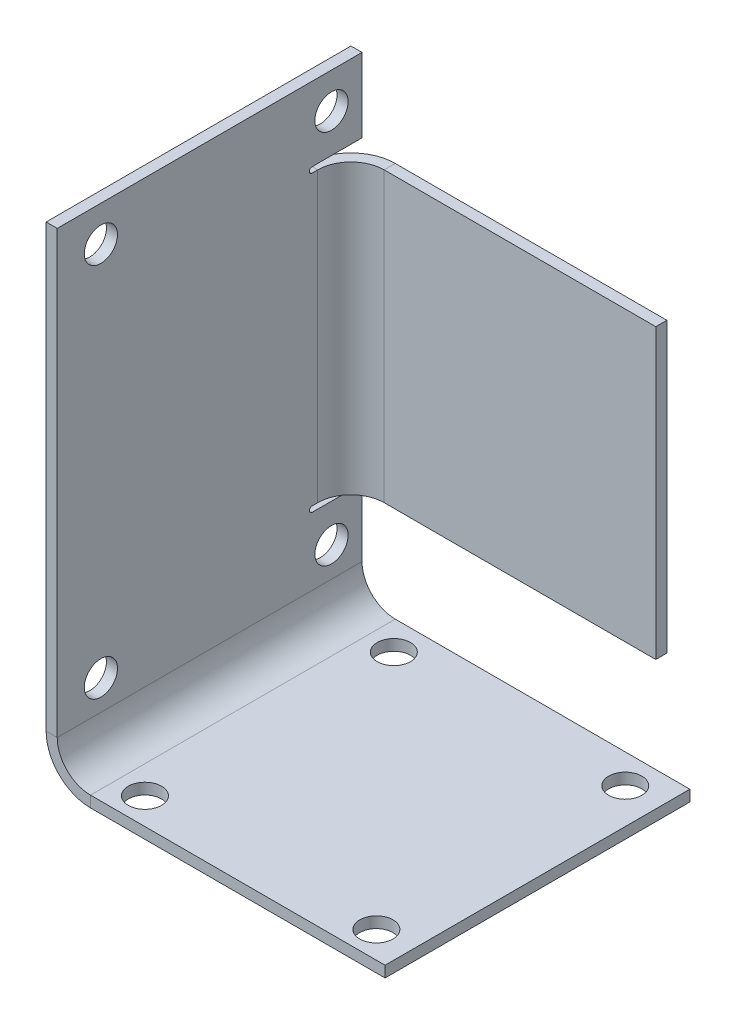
SolidWorks part; units mm, degrees
ref_plane "Alzado" through (0, 0, 0) normal (0, 0, 1) x (1, 0, 0)
ref_plane "Planta" through (0, 0, 0) normal (0, 1, 0) x (1, 0, 0)
ref_plane "Vista lateral" through (0, 0, 0) normal (1, 0, 0) x (0, 0, -1)
sketch "Croquis1" plane through (0, 0, 0) normal (0, 0, 1) x (1, 0, 0)
  line L0 (0, 85.5607) -> (0, 0)
  line L1 (0, 0) -> (59.1549, 0)
extrude "Extruir-Lámina1" add sketch "Croquis1" along normal blind 55 thin
sketch "Croquis2" plane through (0, 0, 0) normal (1, 0, 0) x (0, 0, -1)
  line L0 (0, 71.2036) -> (0, 19.192)
  line L1 (0, 85.5607) -> (0, 0) construction
extrude "Extruir-Lámina2" add sketch "Croquis2" along normal blind 55 thin
sheet metal parameters "Chapa metálica1" parameters "D1"=6
bend "Pliegue de arista viva2" bend angle 90 parameters "D1"=0, "D5"=1
flatten bends "Desplegar pliegues1" parameters "D1"=0
sketch "Croquis de arista viva1" plane through (0, 0, 0) normal (1, 0, 0) x (0, 0, -1)
  line L0 (-55, -0.1261) -> (0, -0.1261) construction
  line L1 (-1.8739, 19.192) -> (-1.8739, 71.2036) construction
bend "Pliegue de arista viva1" bend angle 90 parameters "D1"=0, "D5"=2
process bends "Procesar pliegues1" parameters "D1"=0
sketch "Croquis desplegado1" plane through (0, 0, 0) normal (1, 0, 0) x (0, 0, -1)
sketch "Croquis3" plane through (0, 0, 0) normal (1, 0, 0) x (0, 0, -1)
  circle A0 centre (-5.5129, 79.1522) radius 3
  circle A1 centre (-47.1202, 79.1522) radius 3
  circle A2 centre (-47.1202, 11.3846) radius 3
  circle A3 centre (-5.5129, 11.3846) radius 3
  dimension "D1" = 6
  dimension "D2" = 6
  dimension "D3" = 6
  dimension "D4" = 6
extrude "Cortar-Extruir1" cut sketch "Croquis3" against normal blind 10
sketch "Croquis4" plane through (0, 0, 0) normal (0, 1, 0) x (1, 0, 0)
  circle A0 centre (52.7753, -5.2794) radius 3
  circle A1 centre (11.0157, -5.2794) radius 3
  circle A2 centre (11.0157, -50.1903) radius 3
  circle A3 centre (52.7753, -50.1903) radius 3
  dimension "D1" = 6
  dimension "D2" = 6
  dimension "D3" = 6
  dimension "D4" = 6
extrude "Cortar-Extruir2" cut sketch "Croquis4" against normal blind 10
flat pattern "Chapa desplegada1"
sketch "Líneas de pliegue1" plane through (0, 0, 0) normal (1, 0, 0) x (0, 0, -1)
  line L0 (-1.8739, 71.2036) -> (-1.8739, 19.192) construction
  line L1 (0, -0.1261) -> (-55, -0.1261) construction
  line L2 (-1.8739, 71.2036) -> (-1.8739, 19.192) construction
  line L3 (0, -0.1261) -> (-55, -0.1261) construction
bend of the flat pattern "Aplanar-<Pliegue de arista viva1>1"
bend of the flat pattern "Aplanar-<Pliegue de arista viva2>1"
